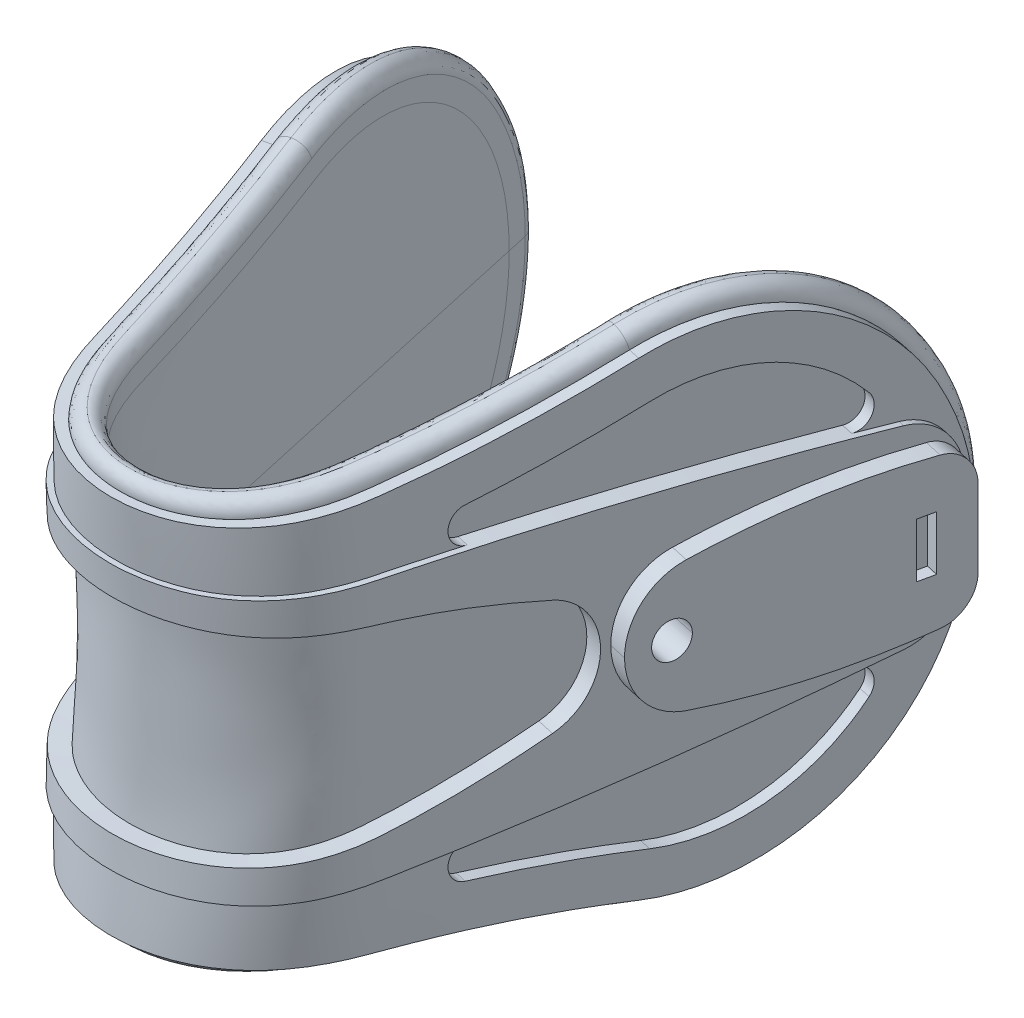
SolidWorks part; units mm, degrees
ref_plane "Face" through (0, 0, 0) normal (0, 0, 1) x (1, 0, 0)
ref_plane "Dessus" through (0, 0, 0) normal (0, 1, 0) x (1, 0, 0)
ref_plane "Droite" through (0, 0, 0) normal (1, 0, 0) x (0, 0, -1)
imported_body "Gsangle21-1-solid1"
imported_body "Gsangle22-1-solid1"
sketch "Esquisse2" plane through (0, 0, 0) normal (0, 1, 0) x (1, 0, 0)
  line L0 (0, -21.9913) -> (0, 150.8716) construction
  line L1 (25.2622, 35.3735) -> (42.5773, 113.4771) construction
  line L2 (-25.2622, 35.3735) -> (-42.5773, 113.4771) construction
  line L3 (16.4755, 37.3214) -> (33.7907, 115.4251)
  line L4 (-16.4755, 37.3214) -> (-33.7907, 115.4251)
  arc A0 (-25.2622, 35.3735) -> (25.2622, 35.3735) centre (0, 40.9739) ccw construction
  arc A1 (-16.4755, 37.3214) -> (16.4755, 37.3214) centre (0, 40.9739) ccw
  dimension "D5" = 70
  dimension "D1" = 12.5
  dimension "D2" = 25
  dimension "D3" = 80
  dimension "D4" = 80
  dimension "D6" = 9
other "Déformer1" parameters "D1"=50, "D2"=50
